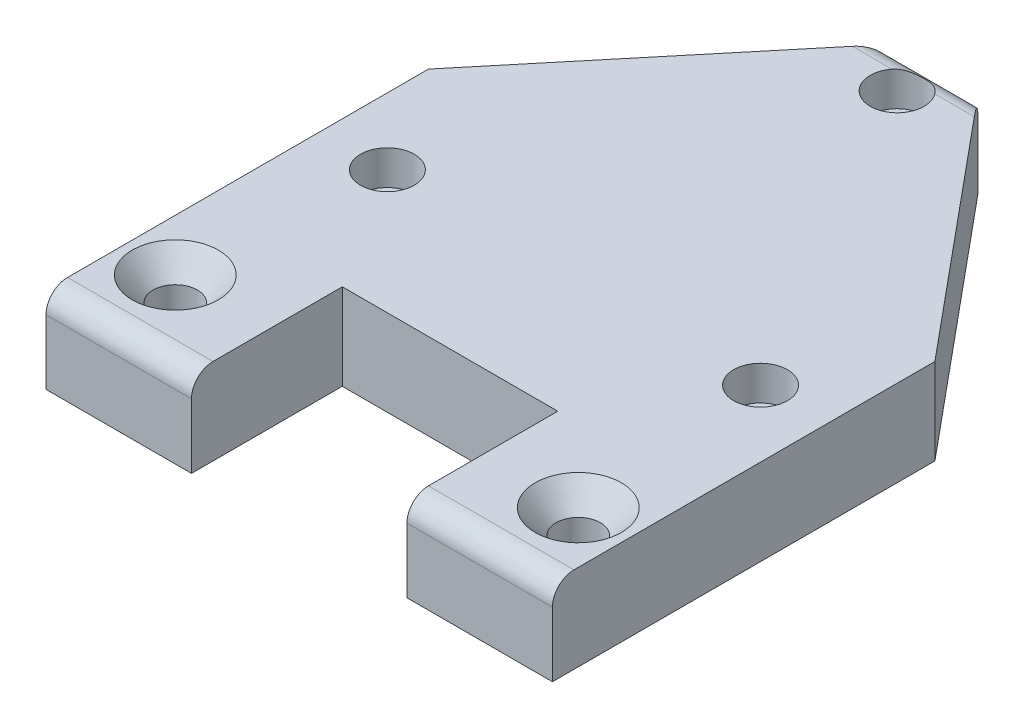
SolidWorks part; units mm, degrees
ref_plane "Front Plane" through (0, 0, 0) normal (0, 0, 1) x (1, 0, 0)
ref_plane "Top Plane" through (0, 0, 0) normal (0, 1, 0) x (1, 0, 0)
ref_plane "Right Plane" through (0, 0, 0) normal (1, 0, 0) x (0, 0, -1)
sketch "Sketch1" plane through (0, 0, 0) normal (0, 1, 0) x (1, 0, 0)
  line L0 (0, 31.75) -> (-27.4963, -15.875) construction
  line L1 (-27.4963, -15.875) -> (0, -15.875) construction
  line L2 (0, 0) -> (0, -15.875) construction
  line L4 (0, -15.875) -> (27.4963, -15.875) construction
  line L5 (27.4963, -15.875) -> (0, 31.75) construction
  line L6 (0, 0) -> (0, 58.8694) construction
  line L7 (6.35, 37.3126) -> (-6.35, 37.3126)
  line L8 (-6.35, 37.3126) -> (-37.3126, 0)
  line L9 (-37.3126, 0) -> (-37.3126, -56.3626)
  line L10 (-37.3126, -56.3626) -> (-15.875, -56.3626)
  line L11 (0, -15.875) -> (0, -54.2103) construction
  line L12 (-15.875, -56.3626) -> (-15.875, -34.1376)
  line L13 (-15.875, -34.1376) -> (15.875, -34.1376)
  line L14 (6.35, 37.3126) -> (37.3126, 0)
  line L15 (37.3126, 0) -> (37.3126, -56.3626)
  line L16 (37.3126, -56.3626) -> (15.875, -56.3626)
  line L17 (15.875, -56.3626) -> (15.875, -34.1376)
  circle A0 centre (0, 0) radius 31.75 construction
  circle A1 centre (0, 0) radius 37.3126 construction
  circle A2 centre (0, 31.75) radius 2.4892
  circle A3 centre (27.4963, -15.875) radius 2.4892
  circle A4 centre (-27.4963, -15.875) radius 2.4892
  point P19 (0, 37.3126)
  point P22 (0, -34.1376)
  dimension "D4" = 74.6252
  dimension "D6" = 31.75
  dimension "D9" = 4.9784
  dimension "D1" = 63.5
  dimension "D2" = 3.175
  dimension "D3" = 60
  dimension "D5" = 12.7
  dimension "D8" = 22.225
extrude "Boss-Extrude1" add sketch "Sketch1" along normal blind 12.7
hole_wizard "F (0.257) Diameter Hole1" positions "Sketch3" profile "Sketch2" hole size "F" standard "Ansi Inch"
sketch "Sketch3" plane through (0, 12.7, 0) normal (0, 1, 0) x (-1, 0, 0)
  line L0 (0, 0) -> (0, 70.3255) construction
  line L2 (37.3126, 56.3626) -> (15.875, 56.3626) construction
  line L3 (37.3126, 0) -> (37.3126, 56.3626) construction
  point P0 (29.6926, 44.9326)
  point P12 (-29.6926, 44.9326)
  dimension "D1" = 11.43
  dimension "D2" = 7.62
sketch "Sketch2" plane through (-29.6926, 12.7, 44.9326) normal (1, 0, 0) x (0, 0, 1)
  line L0 (0, 0) -> (0, 12.7)
  line L1 (0, 12.7) -> (3.2639, 12.7)
  line L2 (3.2639, 12.7) -> (3.2639, 3.5502)
  line L3 (3.2639, 3.5502) -> (6.35, 0)
  line L5 (6.35, 0) -> (0, 0)
  line L6 (-3.2639, 3.5502) -> (-6.35, 0) construction
  line L11 (0, -6.35) -> (0, 107.95) construction
  dimension "Thru Hole Dia." = 6.5278
  dimension "Thru Hole Depth" = 12.7
  dimension "Near C'Sink Dia." = 12.7
  dimension "Near C'Sink Angle" = 82
fillet "Fillet1" radius 3.175 3 edges at (0, 12.7, -37.3126) (26.5938, 12.7, 56.3626) (-26.5938, 12.7, 56.3626)
sketch "Sketch4" plane through (0, 12.7, 0) normal (0, 1, 0) x (1, 0, 0)
  circle A0 centre (0, 31.75) radius 3.9624
  circle A1 centre (-27.4963, -15.875) radius 3.9624
  circle A2 centre (27.4963, -15.875) radius 3.9624
  dimension "D1" = 7.9248
extrude "Cut-Extrude1" cut sketch "Sketch4" against normal blind 5.08
equation "\"Buoyancy\"=\"SW-Volume\"*(\"SW-Density\"-.037062)"
